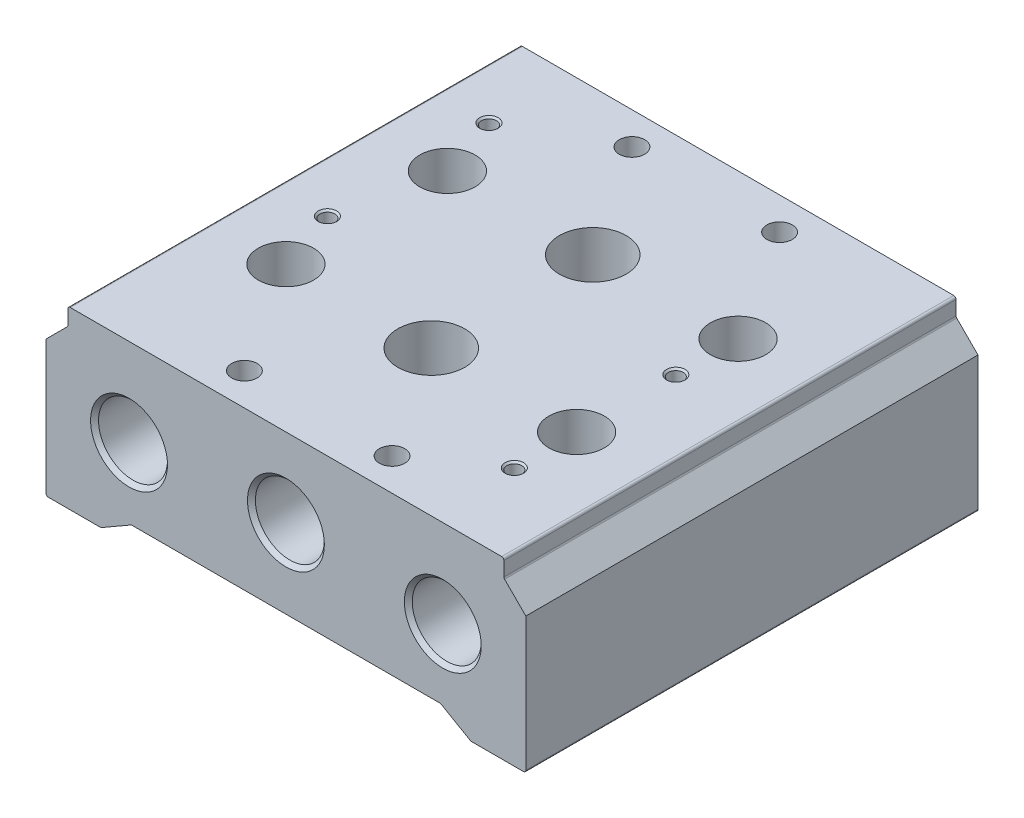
SolidWorks part; units mm, degrees
ref_plane "前视基准面" through (0, 0, 0) normal (0, 0, 1) x (1, 0, 0)
ref_plane "上视基准面" through (0, 0, 0) normal (0, 1, 0) x (1, 0, 0)
ref_plane "右视基准面" through (0, 0, 0) normal (1, 0, 0) x (0, 0, -1)
sketch "草图1" plane through (0, 0, 0) normal (0, 0, 1) x (1, 0, 0)
  line L0 (-52, 29.45) -> (-52, 0.5)
  line L1 (-51.5, 0) -> (-40.2158, 0)
  line L2 (-39.9658, 0.067) -> (-33.616, 3.733)
  line L3 (-33.366, 3.8) -> (33.366, 3.8)
  line L4 (33.616, 3.733) -> (39.9658, 0.067)
  line L5 (40.2158, 0) -> (51.5, 0)
  line L6 (52, 0.5) -> (52, 29.45)
  line L7 (52, 29.45) -> (47.3964, 34.0536)
  line L8 (47.25, 34.4071) -> (47.25, 37.5)
  line L9 (46.75, 38) -> (-46.75, 38)
  line L10 (-47.25, 37.5) -> (-47.25, 34.4071)
  line L11 (-47.3964, 34.0536) -> (-52, 29.45)
  arc A0 (-52, 0.5) -> (-51.5, 0) centre (-51.5, 0.5) ccw
  arc A1 (-40.2158, 0) -> (-39.9658, 0.067) centre (-40.2158, 0.5) ccw
  arc A2 (-33.616, 3.733) -> (-33.366, 3.8) centre (-33.366, 3.3) cw
  arc A3 (33.366, 3.8) -> (33.616, 3.733) centre (33.366, 3.3) cw
  arc A4 (39.9658, 0.067) -> (40.2158, 0) centre (40.2158, 0.5) ccw
  arc A5 (51.5, 0) -> (52, 0.5) centre (51.5, 0.5) ccw
  arc A6 (47.3964, 34.0536) -> (47.25, 34.4071) centre (47.75, 34.4071) cw
  arc A7 (47.25, 37.5) -> (46.75, 38) centre (46.75, 37.5) ccw
  arc A8 (-46.75, 38) -> (-47.25, 37.5) centre (-46.75, 37.5) ccw
  arc A9 (-47.25, 34.4071) -> (-47.3964, 34.0536) centre (-47.75, 34.4071) cw
extrude "凸台-拉伸1" add sketch "草图1" along normal blind 98
sketch "草图2" plane through (0, 0, 0) normal (0, 1, 0) x (1, 0, 0)
  circle A0 centre (-16, -91) radius 2.75
extrude "切除-拉伸1" cut sketch "草图2" along normal blind 38
sketch "草图3" plane through (0, 0, 0) normal (0, 1, 0) x (1, 0, 0)
  line L0 (-16, -91) -> (16, -91)
  line L1 (-16, -91) -> (-16, -7)
pattern_linear "阵列(线性)1" count 2 spacing 32 along (1, 0, 0) count 2 spacing 84 along (0, 0, -1) of "切除-拉伸1"
ref_plane "基准面1" through (0, 20.9, 0) normal (0, 1, 0) x (1, 0, 0)
ref_plane "基准面2" through (0, 19, 0) normal (0, 1, 0) x (1, 0, 0)
sketch "草图4" plane through (0, 19, 0) normal (0, 1, 0) x (1, 0, 0)
  line L0 (34, -98) -> (25.669, -98)
  line L1 (25.669, -98) -> (26.525, -97.144)
  line L2 (26.525, -97.144) -> (26.525, -49)
  line L3 (26.525, -49) -> (34, -49)
  line L4 (34, -49) -> (34, -98)
  line L5 (34, -49) -> (34, -98) construction
revolve "切除-旋转1" cut sketch "草图4" angle 360 about L5
sketch "草图5" plane through (0, 19, 0) normal (0, 1, 0) x (1, 0, 0)
  line L0 (34, -49) -> (26.525, -49)
  line L1 (26.525, -49) -> (26.525, -0.856)
  line L2 (26.525, -0.856) -> (25.669, 0)
  line L3 (25.669, 0) -> (34, 0)
  line L4 (34, 0) -> (34, -49)
  line L5 (34, 0) -> (34, -49) construction
revolve "切除-旋转2" cut sketch "草图5" angle 360 about L5
sketch "草图6" plane through (0, 19, 0) normal (0, 1, 0) x (1, 0, 0)
  line L0 (-34, -98) -> (-42.331, -98)
  line L1 (-42.331, -98) -> (-41.475, -97.144)
  line L2 (-41.475, -97.144) -> (-41.475, -49)
  line L3 (-41.475, -49) -> (-34, -49)
  line L4 (-34, -49) -> (-34, -98)
  line L5 (-34, -49) -> (-34, -98) construction
revolve "切除-旋转3" cut sketch "草图6" angle 360 about L5
sketch "草图7" plane through (0, 19, 0) normal (0, 1, 0) x (1, 0, 0)
  line L0 (-34, -49) -> (-41.475, -49)
  line L1 (-41.475, -49) -> (-41.475, -0.856)
  line L2 (-41.475, -0.856) -> (-42.331, 0)
  line L3 (-42.331, 0) -> (-34, 0)
  line L4 (-34, 0) -> (-34, -49)
  line L5 (-34, 0) -> (-34, -49) construction
revolve "切除-旋转4" cut sketch "草图7" angle 360 about L5
ref_plane "基准面3" through (0, 38, 0) normal (0, 1, 0) x (1, 0, 0)
ref_plane "基准面4" through (0, 0, 14.5) normal (0, 0, 1) x (1, 0, 0)
sketch "草图8" plane through (0, 38, 0) normal (0, 1, 0) x (1, 0, 0)
  circle A0 centre (0, -31.5) radius 7.25
extrude "切除-拉伸2" cut sketch "草图8" against normal blind 13
sketch "草图9" plane through (0, 38, 0) normal (0, 1, 0) x (1, 0, 0)
  line L0 (0, -31.5) -> (0, -66.5)
pattern_linear "阵列(线性)2" count 2 spacing 35 along (0, 0, 1) of "切除-拉伸2"
sketch "草图10" plane through (0, 38, 0) normal (0, 1, 0) x (1, 0, 0)
  circle A0 centre (-31.5, -31.5) radius 6
extrude "切除-拉伸3" cut sketch "草图10" against normal blind 18
sketch "草图11" plane through (0, 38, 0) normal (0, 1, 0) x (1, 0, 0)
  line L0 (-31.5, -31.5) -> (31.5, -31.5)
  line L1 (-31.5, -31.5) -> (-31.5, -66.5)
pattern_linear "阵列(线性)3" count 2 spacing 63 along (1, 0, 0) count 2 spacing 35 along (0, 0, 1) of "切除-拉伸3"
ref_plane "基准面5" through (0, 0, 18) normal (0, 0, 1) x (1, 0, 0)
sketch "草图12" plane through (0, 0, 18) normal (0, 0, 1) x (1, 0, 0)
  line L0 (-36, 31.0641) -> (-37.621, 32)
  line L1 (-37.621, 32) -> (-37.621, 37.621)
  line L2 (-37.621, 37.621) -> (-38, 38)
  line L3 (-38, 38) -> (-36, 38)
  line L4 (-36, 38) -> (-36, 31.0641)
  line L5 (-36, 38) -> (-36, 31.0641) construction
revolve "切除-旋转5" cut sketch "草图12" angle 360 about L5
sketch "草图13" plane through (0, 38, 0) normal (0, 1, 0) x (1, 0, 0)
  line L0 (-36, -18) -> (-36, -53)
  line L1 (-36, -18) -> (31.5, -45)
pattern_linear "阵列(线性)4" count 2 spacing 35 along (0, 0, 1) count 2 spacing 72.6997 along (0.9285, 0, 0.3714) of "切除-旋转5"
ref_plane "基准面6" through (0, 21, 0) normal (0, 1, 0) x (1, 0, 0)
sketch "草图14" plane through (0, 21, 0) normal (0, 1, 0) x (1, 0, 0)
  line L0 (0, -98) -> (-8.331, -98)
  line L1 (-8.331, -98) -> (-7.475, -97.144)
  line L2 (-7.475, -97.144) -> (-7.475, -49)
  line L3 (-7.475, -49) -> (0, -49)
  line L4 (0, -49) -> (0, -98)
  line L5 (0, -49) -> (0, -98) construction
revolve "切除-旋转6" cut sketch "草图14" angle 360 about L5
sketch "草图15" plane through (0, 21, 0) normal (0, 1, 0) x (1, 0, 0)
  line L0 (0, -49) -> (-7.475, -49)
  line L1 (-7.475, -49) -> (-7.475, -0.856)
  line L2 (-7.475, -0.856) -> (-8.331, 0)
  line L3 (-8.331, 0) -> (0, 0)
  line L4 (0, 0) -> (0, -49)
  line L5 (0, 0) -> (0, -49) construction
revolve "切除-旋转7" cut sketch "草图15" angle 360 about L5
